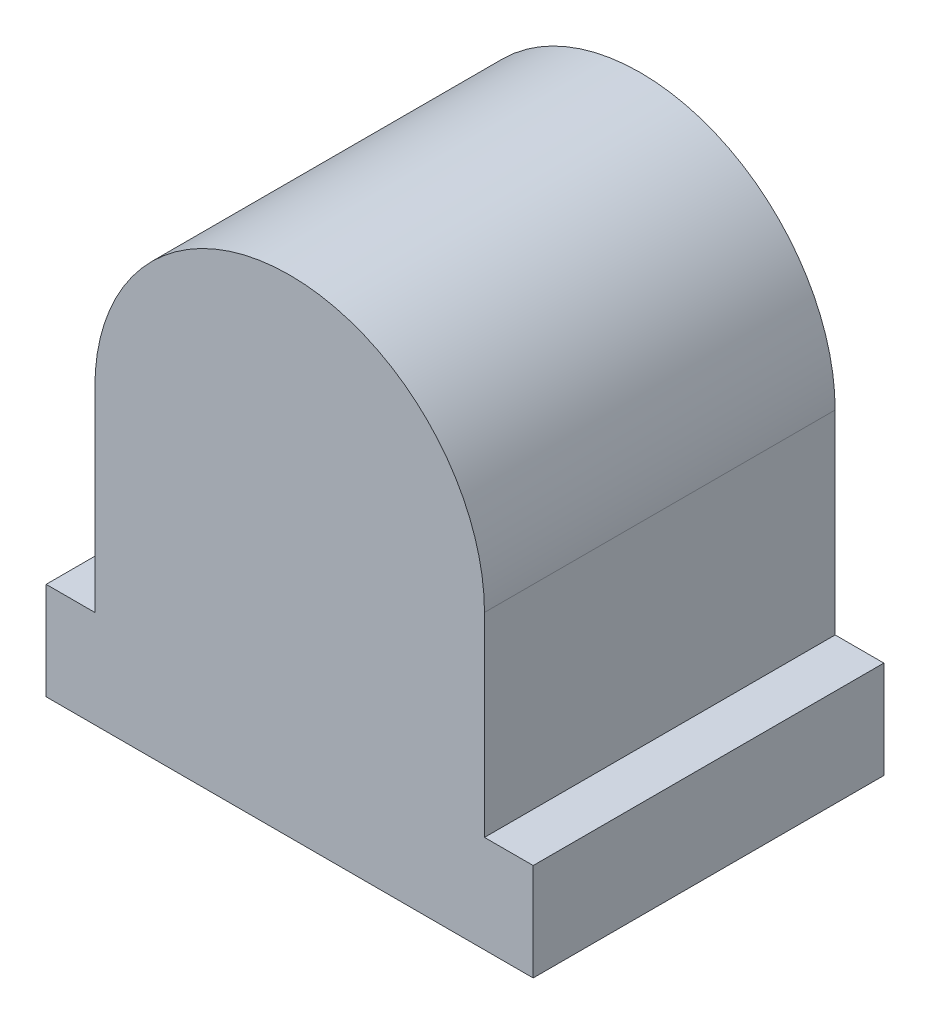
SolidWorks part; units mm, degrees
ref_plane "前视基准面" through (0, 0, 0) normal (0, 0, 1) x (1, 0, 0)
ref_plane "上视基准面" through (0, 0, 0) normal (0, 1, 0) x (1, 0, 0)
ref_plane "右视基准面" through (0, 0, 0) normal (1, 0, 0) x (0, 0, -1)
sketch "草图1" plane through (0, 0, 0) normal (0, 0, 1) x (1, 0, 0)
  line L0 (0, 74.095) -> (0, -46.7734) construction
  line L1 (-32.7759, 16.1907) -> (33.7463, 16.1907) construction
  line L2 (-20, 16.1907) -> (-20, -3.8093)
  line L3 (-20, -3.8093) -> (-25, -3.8093)
  line L4 (-25, -3.8093) -> (-25, -13.8093)
  line L5 (-25, -13.8093) -> (25, -13.8093)
  line L6 (20, -3.8093) -> (25, -3.8093)
  line L7 (25, -3.8093) -> (25, -13.8093)
  line L8 (20, 16.1907) -> (20, -3.8093)
  arc A0 (20, 16.1907) -> (-20, 16.1907) centre (0, 16.1907) ccw
  point P15 (0, -13.8093)
  dimension "D1" = 20
  dimension "D2" = 25
  dimension "D3" = 10
  dimension "D4" = 30
extrude "凸台-拉伸1" add sketch "草图1" along normal blind 36
